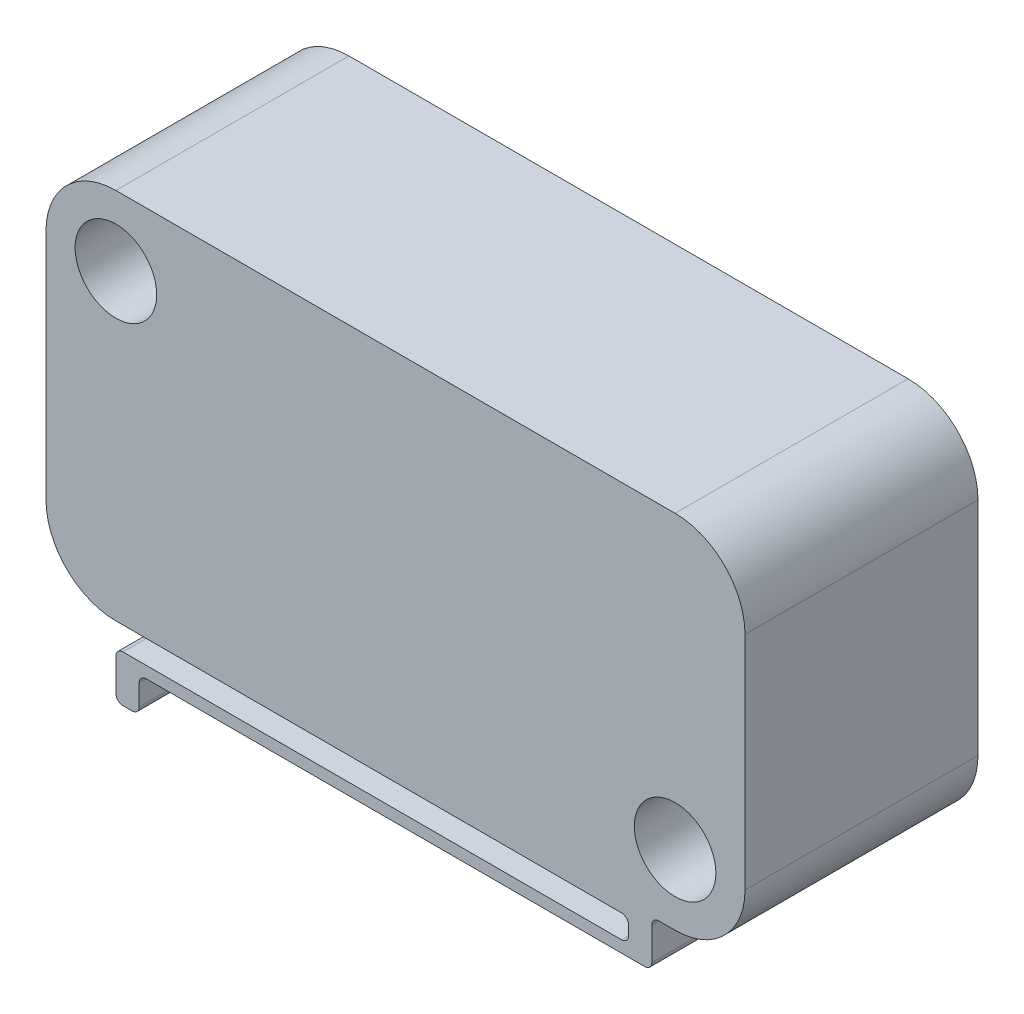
SolidWorks part; units mm, degrees
ref_plane "Plane1" through (0, 0, 0) normal (0, 0, 1) x (1, 0, 0)
ref_plane "Plane2" through (0, 0, 0) normal (0, 1, 0) x (1, 0, 0)
ref_plane "Plane3" through (0, 0, 0) normal (1, 0, 0) x (0, 0, -1)
sketch "Esquisse1" plane through (0, 0, 0) normal (0, 0, 1) x (1, 0, 0)
  line L0 (3, 0) -> (24.7, 0)
  line L1 (0, 3) -> (0, 13)
  line L2 (27, 16) -> (3, 16)
  line L3 (30, 13) -> (30, 3.5)
  line L4 (27, 0.5) -> (26.3, 0.5)
  line L5 (26, 0.2) -> (26, -1.2)
  line L6 (25.7, -1.5) -> (4.3, -1.5)
  line L7 (25, -0.3) -> (25, -0.7)
  line L8 (24.7, -1) -> (3.3, -1)
  line L9 (3, -1.3) -> (3, -2.7)
  line L10 (3.3, -3) -> (3.7, -3)
  line L11 (4, -2.7) -> (4, -1.8)
  arc A0 (30, 13) -> (27, 16) centre (27, 13) ccw
  arc A1 (0, 13) -> (3, 16) centre (3, 13) cw
  arc A2 (3, 0) -> (0, 3) centre (3, 3) cw
  arc A3 (30, 3.5) -> (27, 0.5) centre (27, 3.5) cw
  circle A4 centre (3, 13) radius 1.75
  circle A5 centre (27, 3.5) radius 1.75
  arc A6 (26, 0.2) -> (26.3, 0.5) centre (26.3, 0.2) cw
  arc A7 (24.7, 0) -> (25, -0.3) centre (24.7, -0.3) cw
  arc A8 (24.7, -1) -> (25, -0.7) centre (24.7, -0.7) ccw
  arc A9 (25.7, -1.5) -> (26, -1.2) centre (25.7, -1.2) ccw
  arc A10 (4, -1.8) -> (4.3, -1.5) centre (4.3, -1.8) cw
  arc A11 (4, -2.7) -> (3.7, -3) centre (3.7, -2.7) cw
  arc A12 (3.3, -3) -> (3, -2.7) centre (3.3, -2.7) cw
  arc A13 (3, -1.3) -> (3.3, -1) centre (3.3, -1.3) cw
  dimension "D2" = 3
  dimension "D3" = 3
  dimension "D1" = 3
  dimension "D4" = 3
  dimension "D5" = 3.5
  dimension "D6" = 3.5
  dimension "D7" = 0.3
  dimension "D8" = 0.3
  dimension "D9" = 0.3
  dimension "D10" = 0.3
  dimension "D11" = 0.3
  dimension "D12" = 0.3
  dimension "D13" = 0.3
  dimension "D14" = 0.3
  dimension "D15" = 0.5
extrude "Base-Extrusion" add sketch "Esquisse1" along normal blind 10
